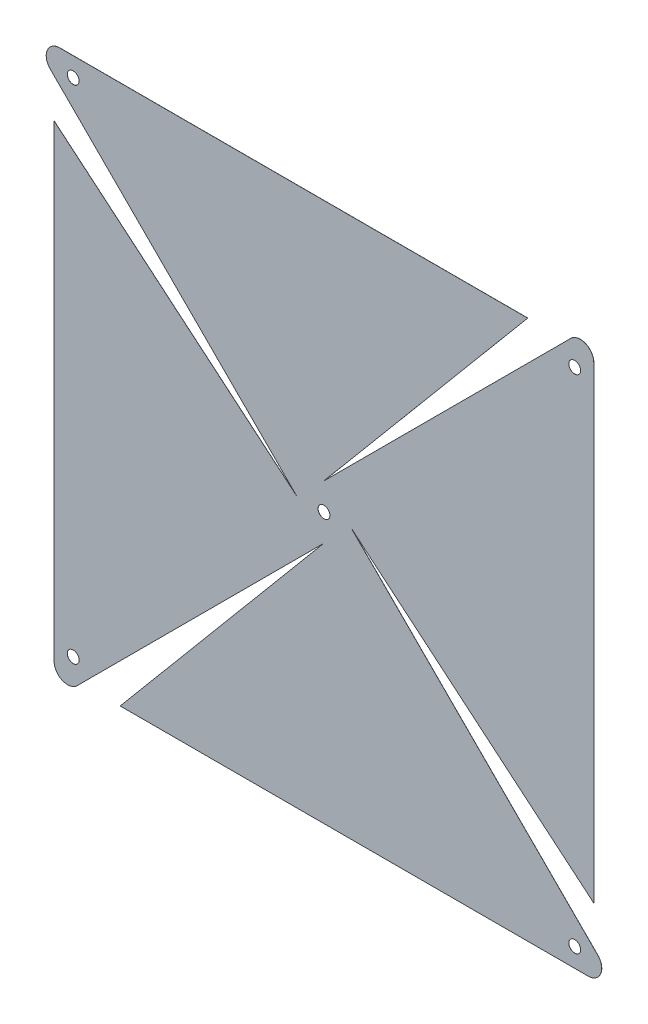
SolidWorks part; units mm, degrees
ref_plane "Front Plane" through (0, 0, 0) normal (0, 0, 1) x (1, 0, 0)
ref_plane "Top Plane" through (0, 0, 0) normal (0, 1, 0) x (1, 0, 0)
ref_plane "Right Plane" through (0, 0, 0) normal (1, 0, 0) x (0, 0, -1)
sketch "Sketch1" plane through (0, 0, 0) normal (0, 0, 1) x (1, 0, 0)
  line L0 (-1000, 0) -> (49000, 0) construction
  line L1 (0, -1000) -> (0, 49000) construction
  line L3 (0, -6.35) -> (35355.3391, -35361.6891) construction
  line L4 (-6.3179, 0.0321) -> (35259.4828, 35265.8328) construction
  line L6 (0, 6.35) -> (63.5, 69.85)
  line L7 (63.5, 69.85) -> (63.5, -47.9545)
  line L8 (6.35, 0) -> (63.5, -47.9545)
  line L9 (0, 0) -> (59.0099, 59.0099) construction
  line L10 (6.35, 0) -> (69.85, -63.5)
  line L11 (69.85, -63.5) -> (-47.9545, -63.5)
  line L12 (0, -6.35) -> (-47.9545, -63.5)
  line L13 (0, -6.35) -> (-63.5, -69.85)
  line L14 (-63.5, -69.85) -> (-63.5, 47.9545)
  line L15 (-6.35, 0) -> (-63.5, 47.9545)
  line L16 (-6.35, 0) -> (-69.85, 63.5)
  line L22 (-69.85, 63.5) -> (47.9545, 63.5)
  line L23 (0, 6.35) -> (47.9545, 63.5)
  circle A0 centre (0, 0) radius 1.3891
  circle A1 centre (0, 0) radius 6.35 construction
  circle A2 centre (59.0099, 59.0099) radius 1.3891
  circle A3 centre (59.0099, -59.0099) radius 1.3891
  circle A4 centre (-59.0099, -59.0099) radius 1.3891
  circle A5 centre (-59.0099, 59.0099) radius 1.3891
  arc A6 (63.5, 58.1167) -> (55.2033, 61.5533) centre (63.5, 69.85) cw construction
  point P9 (0, 6.35)
  point P10 (6.35, 0)
  point P11 (0, -6.35)
  point P12 (-6.35, 0)
  point P36 (0, 0)
  dimension "D1" = 2.7781
  dimension "D2" = 12.7
  dimension "D5" = 4
  dimension "D3" = 63.5
  dimension "D4" = 5
  dimension "D6" = 4
extrude "Boss-Extrude1" add sketch "Sketch1" along normal blind 0.0254
fillet "Fillet1" radius 3.175 4 edges at (-69.85, 63.5, 0.0127) (-63.5, -69.85, 0.0127) (69.85, -63.5, 0.0127) (63.5, 69.85, 0.0127)
